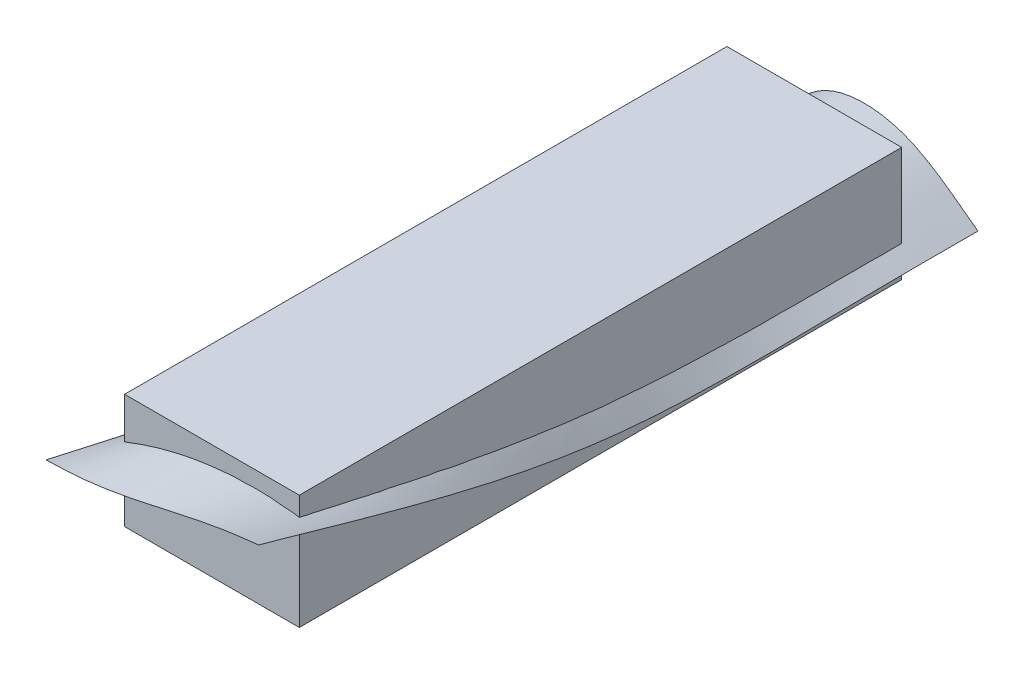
SolidWorks part; units mm, degrees
ref_plane "Front Plane" through (0, 0, 0) normal (0, 0, 1) x (1, 0, 0)
ref_plane "Top Plane" through (0, 0, 0) normal (0, 1, 0) x (1, 0, 0)
ref_plane "Right Plane" through (0, 0, 0) normal (1, 0, 0) x (0, 0, -1)
sketch "Sketch1" plane through (0, 0, 0) normal (0, 0, 1) x (1, 0, 0)
  line L1 (0, 0) -> (91.7382, 0)
  line L2 (0, 0) -> (0, 60.171)
  line L3 (0, 60.171) -> (91.7382, 60.171)
  line L4 (91.7382, 0) -> (91.7382, 60.171)
extrude "Extrude1" add sketch "Sketch1" along normal blind 316.23
sketch "Sketch2" plane through (0, 0, 316.23) normal (0, 0, 1) x (1, 0, 0)
  line L0 (0, 60.171) -> (0, 0) construction
  line L1 (91.7382, 0) -> (91.7382, 60.171) construction
  arc A0 (0, 38.4701) -> (91.7382, 50.0873) centre (67.9442, -130.043) cw
sketch "Sketch3" plane through (0, 0, 0) normal (0, 0, -1) x (-1, 0, 0)
  line L0 (-91.7382, 0) -> (-91.7382, 60.171) construction
  line L1 (0, 60.171) -> (0, 0) construction
  spline S0 degree 3 poles (-91.7382, 16.6038) (-81.1439, 24.3821) (-60.126, 39.8135) (-21.1025, 39.6993) (-6.0003, 23.9885) (0, 17.7464) knots 0 0 0 0 0.379868 0.753614 1 1 1 1
sketch "Sketch4" plane through (0, 0, 158.6367) normal (0, 0, 1) x (1, 0, 0)
  spline S0 degree 3 poles (91.7382, 21.184) (78.0414, 40.3361) (38.3212, 65.5074) (6.9885, 42.3599) (0, 24.2517) knots 0 0 0 0 0.602104 1 1 1 1
surface "Surface-Loft1"
surface "Surface-Untrim1"
